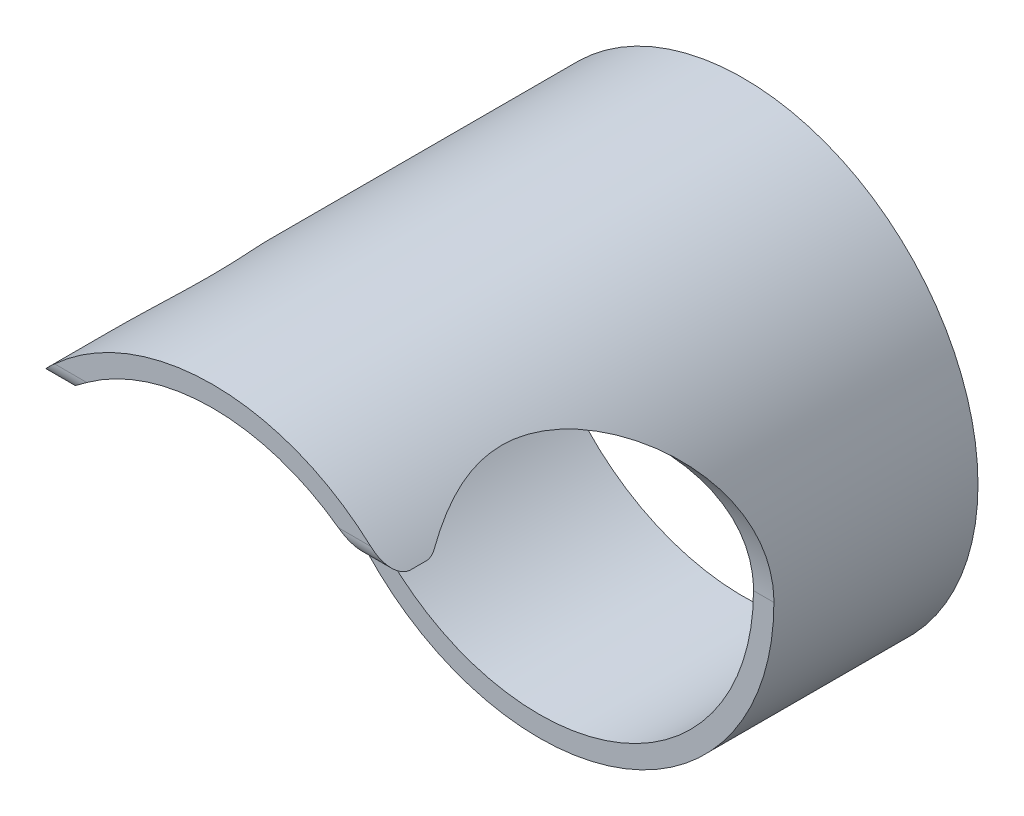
SolidWorks part; units mm, degrees
ref_plane "Plan de face" through (0, 0, 0) normal (0, 0, 1) x (1, 0, 0)
ref_plane "Plan de dessus" through (0, 0, 0) normal (0, 1, 0) x (1, 0, 0)
ref_plane "Plan de droite" through (0, 0, 0) normal (1, 0, 0) x (0, 0, -1)
sketch "Esquisse1" plane through (0, 0, 0) normal (0, 0, 1) x (1, 0, 0)
  circle A0 centre (0, 0) radius 57.5
  circle A1 centre (0, 0) radius 52.5
  dimension "D1" = 115
  dimension "D2" = 105
extrude "Extrusion1" add sketch "Esquisse1" along normal blind 130
sketch "Esquisse2" plane through (0, 0, 0) normal (1, 0, 0) x (0, 0, -1)
  line L0 (-50, 0) -> (-50, -57.5)
  line L1 (-130, -57.5) -> (0, -57.5) construction
  line L2 (-50, -57.5) -> (-130, -57.5)
  line L3 (-130, -57.5) -> (-130, 37.5)
  line L4 (-130, 37.5) -> (-119.8747, 37.5)
  line L5 (-130, 57.5) -> (-130, -57.5) construction
  line L6 (0, -57.5) -> (0, 57.5) construction
  arc A0 (-50, 0) -> (-119.8747, 37.5) centre (-95, 0) ccw
  dimension "D1" = 45
  dimension "D2" = 50
  dimension "D3" = 37.5
extrude "Extrusion2" cut sketch "Esquisse2" against normal through all and the other way through all
fillet "Congé1" radius 5 4 edges at (40.1657, 37.5, 119.8747) (-40.1657, 37.5, 119.8747) (40.1657, 37.5, 130) (-40.1657, 37.5, 130)
